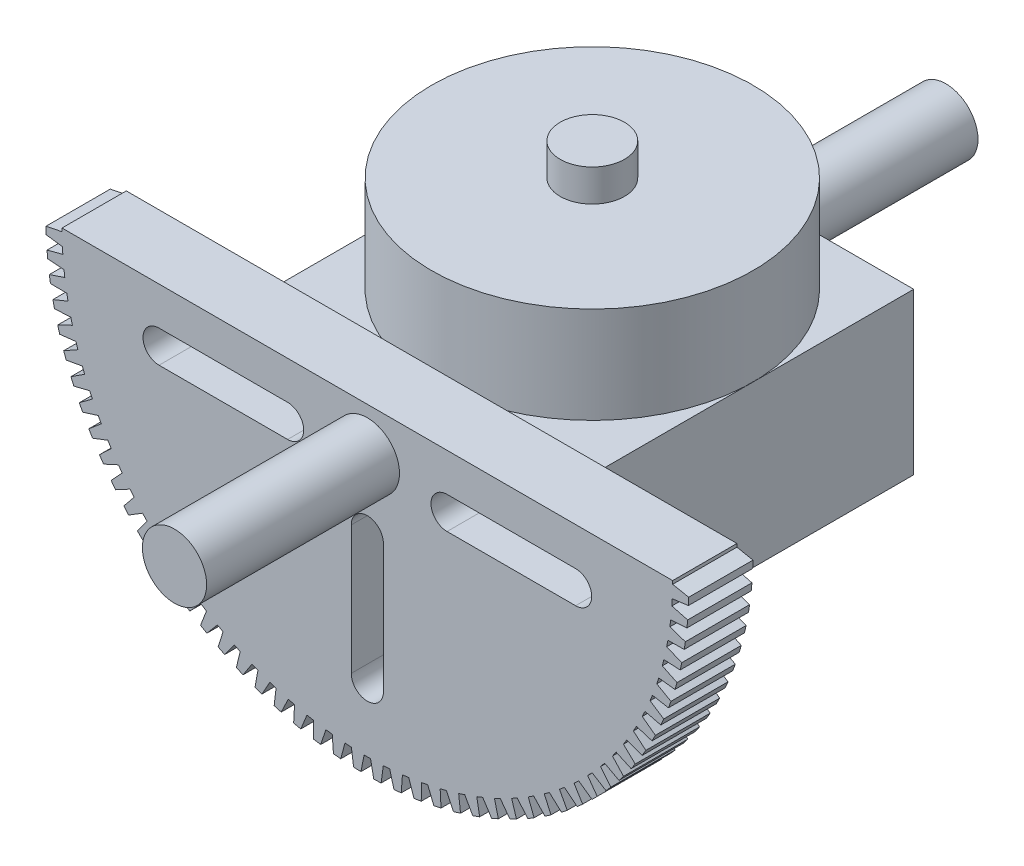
SolidWorks part; units mm, degrees
ref_plane "Front Plane" through (0, 0, 0) normal (0, 0, 1) x (1, 0, 0)
ref_plane "Top Plane" through (0, 0, 0) normal (0, 1, 0) x (1, 0, 0)
ref_plane "Right Plane" through (0, 0, 0) normal (1, 0, 0) x (0, 0, -1)
sketch "Sketch1" plane through (0, 0, 0) normal (0, 0, 1) x (1, 0, 0)
  line L0 (-47.5, 0) -> (-15, 0)
  line L1 (15, 0) -> (47.5, 0)
  line L2 (0, -17.5) -> (0, -37.5) construction
  line L3 (2.5, -17.5) -> (2.5, -37.5)
  line L4 (-2.5, -17.5) -> (-2.5, -37.5)
  line L5 (-32.4018, -8.4364) -> (-12.4018, -8.4364) construction
  line L6 (-32.4018, -5.9364) -> (-12.4018, -5.9364)
  line L7 (-32.4018, -10.9364) -> (-12.4018, -10.9364)
  line L8 (12.4018, -8.4364) -> (32.4018, -8.4364) construction
  line L9 (12.4018, -5.9364) -> (32.4018, -5.9364)
  line L10 (12.4018, -10.9364) -> (32.4018, -10.9364)
  line L11 (0, -47.5) -> (0, -55.9432) construction
  line L12 (-1, -49.99) -> (-0.5, -47.5)
  line L13 (-0.5, -47.5) -> (0.5, -47.5)
  line L14 (0.5, -47.5) -> (1, -49.99)
  line L15 (-4.1369, -49.8286) -> (-3.4816, -47.3749)
  line L16 (-3.4816, -47.3749) -> (-2.4835, -47.4377)
  line L17 (-2.4835, -47.4377) -> (-2.1409, -49.9541)
  line L18 (-7.2575, -49.4705) -> (-6.4494, -47.0628)
  line L19 (-6.4494, -47.0628) -> (-5.4573, -47.1881)
  line L20 (-5.4573, -47.1881) -> (-5.2733, -49.7211)
  line L21 (-10.3495, -48.9172) -> (-9.3918, -46.565)
  line L22 (-9.3918, -46.565) -> (-8.4095, -46.7523)
  line L23 (-8.4095, -46.7523) -> (-8.3849, -49.2919)
  line L24 (-13.4006, -48.1708) -> (-12.2971, -45.8834)
  line L25 (-12.2971, -45.8834) -> (-11.3285, -46.132)
  line L26 (-11.3285, -46.132) -> (-11.4634, -48.6682)
  line L27 (-16.3988, -47.2343) -> (-15.1538, -45.0207)
  line L28 (-15.1538, -45.0207) -> (-14.2028, -45.3297)
  line L29 (-14.2028, -45.3297) -> (-14.4967, -47.8523)
  line L30 (-19.3323, -46.1114) -> (-17.9508, -43.9803)
  line L31 (-17.9508, -43.9803) -> (-17.021, -44.3484)
  line L32 (-17.021, -44.3484) -> (-17.4728, -46.8477)
  line L33 (-22.1895, -44.8065) -> (-20.6769, -42.7664)
  line L34 (-20.6769, -42.7664) -> (-19.7721, -43.1922)
  line L35 (-19.7721, -43.1922) -> (-20.3799, -45.6581)
  line L36 (-24.9592, -43.3248) -> (-23.3215, -41.3837)
  line L37 (-23.3215, -41.3837) -> (-22.4451, -41.8654)
  line L38 (-22.4451, -41.8654) -> (-23.2066, -44.2883)
  line L39 (-27.6303, -41.6721) -> (-25.8739, -39.8377)
  line L40 (-25.8739, -39.8377) -> (-25.0296, -40.3735)
  line L41 (-25.0296, -40.3735) -> (-25.9417, -42.7438)
  line L42 (-30.1924, -39.855) -> (-28.3243, -38.1344)
  line L43 (-28.3243, -38.1344) -> (-27.5153, -38.7222)
  line L44 (-27.5153, -38.7222) -> (-28.5744, -41.0305)
  line L45 (-32.6353, -37.8805) -> (-30.6629, -36.2807)
  line L46 (-30.6629, -36.2807) -> (-29.8924, -36.9181)
  line L47 (-29.8924, -36.9181) -> (-31.0943, -39.1554)
  line L48 (-34.9495, -35.7566) -> (-32.8805, -34.2837)
  line L49 (-32.8805, -34.2837) -> (-32.1515, -34.9683)
  line L50 (-32.1515, -34.9683) -> (-33.4915, -37.1257)
  line L51 (-37.1257, -33.4915) -> (-34.9683, -32.1515)
  line L52 (-34.9683, -32.1515) -> (-34.2837, -32.8805)
  line L53 (-34.2837, -32.8805) -> (-35.7566, -34.9495)
  line L54 (-39.1554, -31.0943) -> (-36.9181, -29.8924)
  line L55 (-36.9181, -29.8924) -> (-36.2807, -30.6629)
  line L56 (-36.2807, -30.6629) -> (-37.8805, -32.6353)
  line L57 (-41.0305, -28.5744) -> (-38.7222, -27.5153)
  line L58 (-38.7222, -27.5153) -> (-38.1344, -28.3243)
  line L59 (-38.1344, -28.3243) -> (-39.855, -30.1924)
  line L60 (-42.7438, -25.9417) -> (-40.3735, -25.0296)
  line L61 (-40.3735, -25.0296) -> (-39.8377, -25.8739)
  line L62 (-39.8377, -25.8739) -> (-41.6721, -27.6303)
  line L63 (-44.2883, -23.2066) -> (-41.8654, -22.4451)
  line L64 (-41.8654, -22.4451) -> (-41.3837, -23.3215)
  line L65 (-41.3837, -23.3215) -> (-43.3248, -24.9592)
  line L66 (-45.6581, -20.3799) -> (-43.1922, -19.7721)
  line L67 (-43.1922, -19.7721) -> (-42.7664, -20.6769)
  line L68 (-42.7664, -20.6769) -> (-44.8065, -22.1895)
  line L69 (-46.8477, -17.4728) -> (-44.3484, -17.021)
  line L70 (-44.3484, -17.021) -> (-43.9803, -17.9508)
  line L71 (-43.9803, -17.9508) -> (-46.1114, -19.3323)
  line L72 (-47.8523, -14.4967) -> (-45.3297, -14.2028)
  line L73 (-45.3297, -14.2028) -> (-45.0207, -15.1538)
  line L74 (-45.0207, -15.1538) -> (-47.2343, -16.3988)
  line L75 (-48.6682, -11.4634) -> (-46.132, -11.3285)
  line L76 (-46.132, -11.3285) -> (-45.8834, -12.2971)
  line L77 (-45.8834, -12.2971) -> (-48.1708, -13.4006)
  line L78 (-49.2919, -8.3849) -> (-46.7523, -8.4095)
  line L79 (-46.7523, -8.4095) -> (-46.565, -9.3918)
  line L80 (-46.565, -9.3918) -> (-48.9172, -10.3495)
  line L81 (-49.7211, -5.2733) -> (-47.1881, -5.4573)
  line L82 (-47.1881, -5.4573) -> (-47.0628, -6.4494)
  line L83 (-47.0628, -6.4494) -> (-49.4705, -7.2575)
  line L84 (-49.9541, -2.1409) -> (-47.4377, -2.4835)
  line L85 (-47.4377, -2.4835) -> (-47.3749, -3.4816)
  line L86 (-47.3749, -3.4816) -> (-49.8286, -4.1369)
  line L87 (-15, 0) -> (15, 0)
  line L88 (-47.5, 0) -> (-47.5, -0.5)
  line L89 (-47.5, -0.5) -> (-49.99, -1)
  line L237 (49.99, -1) -> (47.5, -0.5)
  line L238 (47.5, -0.5) -> (47.5, 0)
  line L240 (49.8286, -4.1369) -> (47.3749, -3.4816)
  line L241 (47.3749, -3.4816) -> (47.4377, -2.4835)
  line L242 (47.4377, -2.4835) -> (49.9541, -2.1409)
  line L243 (49.4705, -7.2575) -> (47.0628, -6.4494)
  line L244 (47.0628, -6.4494) -> (47.1881, -5.4573)
  line L245 (47.1881, -5.4573) -> (49.7211, -5.2733)
  line L246 (48.9172, -10.3495) -> (46.565, -9.3918)
  line L247 (46.565, -9.3918) -> (46.7523, -8.4095)
  line L248 (46.7523, -8.4095) -> (49.2919, -8.3849)
  line L249 (48.1708, -13.4006) -> (45.8834, -12.2971)
  line L250 (45.8834, -12.2971) -> (46.132, -11.3285)
  line L251 (46.132, -11.3285) -> (48.6682, -11.4634)
  line L252 (47.2343, -16.3988) -> (45.0207, -15.1538)
  line L253 (45.0207, -15.1538) -> (45.3297, -14.2028)
  line L254 (45.3297, -14.2028) -> (47.8523, -14.4967)
  line L255 (46.1114, -19.3323) -> (43.9803, -17.9508)
  line L256 (43.9803, -17.9508) -> (44.3484, -17.021)
  line L257 (44.3484, -17.021) -> (46.8477, -17.4728)
  line L258 (44.8065, -22.1895) -> (42.7664, -20.6769)
  line L259 (42.7664, -20.6769) -> (43.1922, -19.7721)
  line L260 (43.1922, -19.7721) -> (45.6581, -20.3799)
  line L261 (43.3248, -24.9592) -> (41.3837, -23.3215)
  line L262 (41.3837, -23.3215) -> (41.8654, -22.4451)
  line L263 (41.8654, -22.4451) -> (44.2883, -23.2066)
  line L264 (41.6721, -27.6303) -> (39.8377, -25.8739)
  line L265 (39.8377, -25.8739) -> (40.3735, -25.0296)
  line L266 (40.3735, -25.0296) -> (42.7438, -25.9417)
  line L267 (39.855, -30.1924) -> (38.1344, -28.3243)
  line L268 (38.1344, -28.3243) -> (38.7222, -27.5153)
  line L269 (38.7222, -27.5153) -> (41.0305, -28.5744)
  line L270 (37.8805, -32.6353) -> (36.2807, -30.6629)
  line L271 (36.2807, -30.6629) -> (36.9181, -29.8924)
  line L272 (36.9181, -29.8924) -> (39.1554, -31.0943)
  line L273 (35.7566, -34.9495) -> (34.2837, -32.8805)
  line L274 (34.2837, -32.8805) -> (34.9683, -32.1515)
  line L275 (34.9683, -32.1515) -> (37.1257, -33.4915)
  line L276 (33.4915, -37.1257) -> (32.1515, -34.9683)
  line L277 (32.1515, -34.9683) -> (32.8805, -34.2837)
  line L278 (32.8805, -34.2837) -> (34.9495, -35.7566)
  line L279 (31.0943, -39.1554) -> (29.8924, -36.9181)
  line L280 (29.8924, -36.9181) -> (30.6629, -36.2807)
  line L281 (30.6629, -36.2807) -> (32.6353, -37.8805)
  line L282 (28.5744, -41.0305) -> (27.5153, -38.7222)
  line L283 (27.5153, -38.7222) -> (28.3243, -38.1344)
  line L284 (28.3243, -38.1344) -> (30.1924, -39.855)
  line L285 (25.9417, -42.7438) -> (25.0296, -40.3735)
  line L286 (25.0296, -40.3735) -> (25.8739, -39.8377)
  line L287 (25.8739, -39.8377) -> (27.6303, -41.6721)
  line L288 (23.2066, -44.2883) -> (22.4451, -41.8654)
  line L289 (22.4451, -41.8654) -> (23.3215, -41.3837)
  line L290 (23.3215, -41.3837) -> (24.9592, -43.3248)
  line L291 (20.3799, -45.6581) -> (19.7721, -43.1922)
  line L292 (19.7721, -43.1922) -> (20.6769, -42.7664)
  line L293 (20.6769, -42.7664) -> (22.1895, -44.8065)
  line L294 (17.4728, -46.8477) -> (17.021, -44.3484)
  line L295 (17.021, -44.3484) -> (17.9508, -43.9803)
  line L296 (17.9508, -43.9803) -> (19.3323, -46.1114)
  line L297 (14.4967, -47.8523) -> (14.2028, -45.3297)
  line L298 (14.2028, -45.3297) -> (15.1538, -45.0207)
  line L299 (15.1538, -45.0207) -> (16.3988, -47.2343)
  line L300 (11.4634, -48.6682) -> (11.3285, -46.132)
  line L301 (11.3285, -46.132) -> (12.2971, -45.8834)
  line L302 (12.2971, -45.8834) -> (13.4006, -48.1708)
  line L303 (8.3849, -49.2919) -> (8.4095, -46.7523)
  line L304 (8.4095, -46.7523) -> (9.3918, -46.565)
  line L305 (9.3918, -46.565) -> (10.3495, -48.9172)
  line L306 (5.2733, -49.7211) -> (5.4573, -47.1881)
  line L307 (5.4573, -47.1881) -> (6.4494, -47.0628)
  line L308 (6.4494, -47.0628) -> (7.2575, -49.4705)
  line L309 (2.1409, -49.9541) -> (2.4835, -47.4377)
  line L310 (2.4835, -47.4377) -> (3.4816, -47.3749)
  line L311 (3.4816, -47.3749) -> (4.1369, -49.8286)
  line L312 (-49.8286, 4.1369) -> (-47.3749, 3.4816)
  line L313 (-49.4705, 7.2575) -> (-47.0628, 6.4494)
  line L314 (-47.0628, 6.4494) -> (-47.1881, 5.4573)
  line L315 (-47.1881, 5.4573) -> (-49.7211, 5.2733)
  line L316 (-48.9172, 10.3495) -> (-46.565, 9.3918)
  line L317 (-46.565, 9.3918) -> (-46.7523, 8.4095)
  line L318 (-46.7523, 8.4095) -> (-49.2919, 8.3849)
  line L319 (-48.1708, 13.4006) -> (-45.8834, 12.2971)
  line L320 (-45.8834, 12.2971) -> (-46.132, 11.3285)
  line L321 (-46.132, 11.3285) -> (-48.6682, 11.4634)
  line L322 (-47.2343, 16.3988) -> (-45.0207, 15.1538)
  line L323 (-45.0207, 15.1538) -> (-45.3297, 14.2028)
  line L324 (-45.3297, 14.2028) -> (-47.8523, 14.4967)
  line L325 (-46.1114, 19.3323) -> (-43.9803, 17.9508)
  line L326 (-43.9803, 17.9508) -> (-44.3484, 17.021)
  line L327 (-44.3484, 17.021) -> (-46.8477, 17.4728)
  line L328 (-44.8065, 22.1895) -> (-42.7664, 20.6769)
  line L329 (-42.7664, 20.6769) -> (-43.1922, 19.7721)
  line L330 (-43.1922, 19.7721) -> (-45.6581, 20.3799)
  line L331 (-43.3248, 24.9592) -> (-41.3837, 23.3215)
  line L332 (-41.3837, 23.3215) -> (-41.8654, 22.4451)
  line L333 (-41.8654, 22.4451) -> (-44.2883, 23.2066)
  line L334 (-41.6721, 27.6303) -> (-39.8377, 25.8739)
  line L335 (-39.8377, 25.8739) -> (-40.3735, 25.0296)
  line L336 (-40.3735, 25.0296) -> (-42.7438, 25.9417)
  line L337 (-39.855, 30.1924) -> (-38.1344, 28.3243)
  line L338 (-38.1344, 28.3243) -> (-38.7222, 27.5153)
  line L339 (-38.7222, 27.5153) -> (-41.0305, 28.5744)
  line L340 (-37.8805, 32.6353) -> (-36.2807, 30.6629)
  line L341 (-36.2807, 30.6629) -> (-36.9181, 29.8924)
  line L342 (-36.9181, 29.8924) -> (-39.1554, 31.0943)
  line L343 (-35.7566, 34.9495) -> (-34.2837, 32.8805)
  line L344 (-34.2837, 32.8805) -> (-34.9683, 32.1515)
  line L345 (-34.9683, 32.1515) -> (-37.1257, 33.4915)
  line L346 (-32.1515, 34.9683) -> (-32.8805, 34.2837)
  line L347 (27.6303, 41.6721) -> (25.8739, 39.8377)
  line L348 (25.8739, 39.8377) -> (25.0296, 40.3735)
  line L349 (25.0296, 40.3735) -> (25.9417, 42.7438)
  line L350 (30.1924, 39.855) -> (28.3243, 38.1344)
  line L351 (28.3243, 38.1344) -> (27.5153, 38.7222)
  line L352 (27.5153, 38.7222) -> (28.5744, 41.0305)
  line L353 (32.6353, 37.8805) -> (30.6629, 36.2807)
  line L354 (30.6629, 36.2807) -> (29.8924, 36.9181)
  line L355 (29.8924, 36.9181) -> (31.0943, 39.1554)
  line L356 (34.9495, 35.7566) -> (32.8805, 34.2837)
  line L357 (32.8805, 34.2837) -> (32.1515, 34.9683)
  line L358 (32.1515, 34.9683) -> (33.4915, 37.1257)
  line L359 (37.1257, 33.4915) -> (34.9683, 32.1515)
  line L360 (34.9683, 32.1515) -> (34.2837, 32.8805)
  line L361 (34.2837, 32.8805) -> (35.7566, 34.9495)
  line L362 (39.1554, 31.0943) -> (36.9181, 29.8924)
  line L363 (36.9181, 29.8924) -> (36.2807, 30.6629)
  line L364 (36.2807, 30.6629) -> (37.8805, 32.6353)
  line L365 (41.0305, 28.5744) -> (38.7222, 27.5153)
  line L366 (38.7222, 27.5153) -> (38.1344, 28.3243)
  line L367 (38.1344, 28.3243) -> (39.855, 30.1924)
  line L368 (42.7438, 25.9417) -> (40.3735, 25.0296)
  line L369 (40.3735, 25.0296) -> (39.8377, 25.8739)
  line L370 (39.8377, 25.8739) -> (41.6721, 27.6303)
  line L371 (44.2883, 23.2066) -> (41.8654, 22.4451)
  line L372 (41.8654, 22.4451) -> (41.3837, 23.3215)
  line L373 (41.3837, 23.3215) -> (43.3248, 24.9592)
  line L374 (45.6581, 20.3799) -> (43.1922, 19.7721)
  line L375 (43.1922, 19.7721) -> (42.7664, 20.6769)
  line L376 (42.7664, 20.6769) -> (44.8065, 22.1895)
  line L377 (46.8477, 17.4728) -> (44.3484, 17.021)
  line L378 (44.3484, 17.021) -> (43.9803, 17.9508)
  line L379 (43.9803, 17.9508) -> (46.1114, 19.3323)
  line L380 (47.8523, 14.4967) -> (45.3297, 14.2028)
  line L381 (45.3297, 14.2028) -> (45.0207, 15.1538)
  line L382 (45.0207, 15.1538) -> (47.2343, 16.3988)
  line L383 (48.6682, 11.4634) -> (46.132, 11.3285)
  line L384 (46.132, 11.3285) -> (45.8834, 12.2971)
  line L385 (45.8834, 12.2971) -> (48.1708, 13.4006)
  line L386 (49.2919, 8.3849) -> (46.7523, 8.4095)
  line L387 (46.7523, 8.4095) -> (46.565, 9.3918)
  line L388 (46.565, 9.3918) -> (48.9172, 10.3495)
  line L389 (49.7211, 5.2733) -> (47.1881, 5.4573)
  line L390 (47.1881, 5.4573) -> (47.0628, 6.4494)
  line L391 (47.0628, 6.4494) -> (49.4705, 7.2575)
  line L392 (49.9541, 2.1409) -> (47.4377, 2.4835)
  line L393 (47.4377, 2.4835) -> (47.3749, 3.4816)
  line L394 (47.3749, 3.4816) -> (49.8286, 4.1369)
  line L395 (47.5, 0.5) -> (49.99, 1)
  line L396 (-33.4915, 37.1257) -> (-32.1515, 34.9683)
  line L397 (-32.8805, 34.2837) -> (-34.9495, 35.7566)
  line L398 (-31.0943, 39.1554) -> (-29.8924, 36.9181)
  line L399 (-29.8924, 36.9181) -> (-30.6629, 36.2807)
  line L400 (-30.6629, 36.2807) -> (-32.6353, 37.8805)
  line L401 (-28.5744, 41.0305) -> (-27.5153, 38.7222)
  line L402 (-27.5153, 38.7222) -> (-28.3243, 38.1344)
  line L403 (-28.3243, 38.1344) -> (-30.1924, 39.855)
  line L404 (-25.9417, 42.7438) -> (-25.0296, 40.3735)
  line L405 (-25.0296, 40.3735) -> (-25.8739, 39.8377)
  line L406 (-25.8739, 39.8377) -> (-27.6303, 41.6721)
  line L407 (-23.2066, 44.2883) -> (-22.4451, 41.8654)
  line L408 (-22.4451, 41.8654) -> (-23.3215, 41.3837)
  line L409 (-23.3215, 41.3837) -> (-24.9592, 43.3248)
  line L410 (-20.3799, 45.6581) -> (-19.7721, 43.1922)
  line L411 (-19.7721, 43.1922) -> (-20.6769, 42.7664)
  line L412 (-20.6769, 42.7664) -> (-22.1895, 44.8065)
  line L413 (-17.4728, 46.8477) -> (-17.021, 44.3484)
  line L414 (-17.021, 44.3484) -> (-17.9508, 43.9803)
  line L415 (-17.9508, 43.9803) -> (-19.3323, 46.1114)
  line L416 (-14.4967, 47.8523) -> (-14.2028, 45.3297)
  line L417 (-14.2028, 45.3297) -> (-15.1538, 45.0207)
  line L418 (-15.1538, 45.0207) -> (-16.3988, 47.2343)
  line L419 (-11.4634, 48.6682) -> (-11.3285, 46.132)
  line L420 (-11.3285, 46.132) -> (-12.2971, 45.8834)
  line L421 (-12.2971, 45.8834) -> (-13.4006, 48.1708)
  line L422 (-8.3849, 49.2919) -> (-8.4095, 46.7523)
  line L423 (-8.4095, 46.7523) -> (-9.3918, 46.565)
  line L424 (-9.3918, 46.565) -> (-10.3495, 48.9172)
  line L425 (-6.4494, 47.0628) -> (-7.2575, 49.4705)
  line L426 (1, 49.99) -> (0.5, 47.5)
  line L427 (4.1369, 49.8286) -> (3.4816, 47.3749)
  line L428 (3.4816, 47.3749) -> (2.4835, 47.4377)
  line L429 (2.4835, 47.4377) -> (2.1409, 49.9541)
  line L430 (7.2575, 49.4705) -> (6.4494, 47.0628)
  line L431 (6.4494, 47.0628) -> (5.4573, 47.1881)
  line L432 (5.4573, 47.1881) -> (5.2733, 49.7211)
  line L433 (10.3495, 48.9172) -> (9.3918, 46.565)
  line L434 (9.3918, 46.565) -> (8.4095, 46.7523)
  line L435 (8.4095, 46.7523) -> (8.3849, 49.2919)
  line L436 (13.4006, 48.1708) -> (12.2971, 45.8834)
  line L437 (12.2971, 45.8834) -> (11.3285, 46.132)
  line L438 (11.3285, 46.132) -> (11.4634, 48.6682)
  line L439 (16.3988, 47.2343) -> (15.1538, 45.0207)
  line L440 (15.1538, 45.0207) -> (14.2028, 45.3297)
  line L441 (14.2028, 45.3297) -> (14.4967, 47.8523)
  line L442 (19.3323, 46.1114) -> (17.9508, 43.9803)
  line L443 (17.9508, 43.9803) -> (17.021, 44.3484)
  line L444 (17.021, 44.3484) -> (17.4728, 46.8477)
  line L445 (22.1895, 44.8065) -> (20.6769, 42.7664)
  line L446 (20.6769, 42.7664) -> (19.7721, 43.1922)
  line L447 (19.7721, 43.1922) -> (20.3799, 45.6581)
  line L448 (24.9592, 43.3248) -> (23.3215, 41.3837)
  line L449 (23.3215, 41.3837) -> (22.4451, 41.8654)
  line L450 (22.4451, 41.8654) -> (23.2066, 44.2883)
  line L451 (-2.1409, 49.9541) -> (-2.4835, 47.4377)
  line L452 (-2.4835, 47.4377) -> (-3.4816, 47.3749)
  line L453 (0.5, 47.5) -> (-0.5, 47.5)
  line L454 (-0.5, 47.5) -> (-1, 49.99)
  line L455 (-3.4816, 47.3749) -> (-4.1369, 49.8286)
  line L456 (-5.2733, 49.7211) -> (-5.4573, 47.1881)
  line L457 (-5.4573, 47.1881) -> (-6.4494, 47.0628)
  line L458 (-47.3749, 3.4816) -> (-47.4377, 2.4835)
  line L459 (-47.4377, 2.4835) -> (-49.9541, 2.1409)
  line L460 (-49.99, 1) -> (-47.5, 0.5)
  arc A0 (-49.99, -1) -> (-49.9541, -2.1409) centre (0, 0) ccw
  circle A1 centre (0, -10) radius 10 construction
  arc A3 (2.5, -17.5) -> (-2.5, -17.5) centre (0, -17.5) ccw
  arc A4 (-2.5, -37.5) -> (2.5, -37.5) centre (0, -37.5) ccw
  arc A5 (-32.4018, -5.9364) -> (-32.4018, -10.9364) centre (-32.4018, -8.4364) ccw
  arc A6 (-12.4018, -10.9364) -> (-12.4018, -5.9364) centre (-12.4018, -8.4364) ccw
  arc A7 (12.4018, -5.9364) -> (12.4018, -10.9364) centre (12.4018, -8.4364) ccw
  arc A8 (32.4018, -10.9364) -> (32.4018, -5.9364) centre (32.4018, -8.4364) ccw
  arc A9 (49.9541, -2.1409) -> (49.99, -1) centre (0, 0) ccw
  arc A10 (49.7211, -5.2733) -> (49.8286, -4.1369) centre (0, 0) ccw
  arc A11 (49.2919, -8.3849) -> (49.4705, -7.2575) centre (0, 0) ccw
  arc A12 (48.6682, -11.4634) -> (48.9172, -10.3495) centre (0, 0) ccw
  arc A13 (47.8523, -14.4967) -> (48.1708, -13.4006) centre (0, 0) ccw
  arc A14 (46.8477, -17.4728) -> (47.2343, -16.3988) centre (0, 0) ccw
  arc A15 (45.6581, -20.3799) -> (46.1114, -19.3323) centre (0, 0) ccw
  arc A16 (44.2883, -23.2066) -> (44.8065, -22.1895) centre (0, 0) ccw
  arc A17 (42.7438, -25.9417) -> (43.3248, -24.9592) centre (0, 0) ccw
  arc A18 (41.0305, -28.5744) -> (41.6721, -27.6303) centre (0, 0) ccw
  arc A19 (39.1554, -31.0943) -> (39.855, -30.1924) centre (0, 0) ccw
  arc A20 (37.1257, -33.4915) -> (37.8805, -32.6353) centre (0, 0) ccw
  arc A21 (34.9495, -35.7566) -> (35.7566, -34.9495) centre (0, 0) ccw
  arc A22 (32.6353, -37.8805) -> (33.4915, -37.1257) centre (0, 0) ccw
  arc A23 (30.1924, -39.855) -> (31.0943, -39.1554) centre (0, 0) ccw
  arc A24 (27.6303, -41.6721) -> (28.5744, -41.0305) centre (0, 0) ccw
  arc A25 (24.9592, -43.3248) -> (25.9417, -42.7438) centre (0, 0) ccw
  arc A26 (22.1895, -44.8065) -> (23.2066, -44.2883) centre (0, 0) ccw
  arc A27 (19.3323, -46.1114) -> (20.3799, -45.6581) centre (0, 0) ccw
  arc A28 (16.3988, -47.2343) -> (17.4728, -46.8477) centre (0, 0) ccw
  arc A29 (13.4006, -48.1708) -> (14.4967, -47.8523) centre (0, 0) ccw
  arc A30 (10.3495, -48.9172) -> (11.4634, -48.6682) centre (0, 0) ccw
  arc A31 (7.2575, -49.4705) -> (8.3849, -49.2919) centre (0, 0) ccw
  arc A32 (4.1369, -49.8286) -> (5.2733, -49.7211) centre (0, 0) ccw
  arc A33 (1, -49.99) -> (2.1409, -49.9541) centre (0, 0) ccw
  arc A34 (-2.1409, -49.9541) -> (-1, -49.99) centre (0, 0) ccw
  arc A35 (-5.2733, -49.7211) -> (-4.1369, -49.8286) centre (0, 0) ccw
  arc A36 (-8.3849, -49.2919) -> (-7.2575, -49.4705) centre (0, 0) ccw
  arc A37 (-11.4634, -48.6682) -> (-10.3495, -48.9172) centre (0, 0) ccw
  arc A38 (-14.4967, -47.8523) -> (-13.4006, -48.1708) centre (0, 0) ccw
  arc A39 (-17.4728, -46.8477) -> (-16.3988, -47.2343) centre (0, 0) ccw
  arc A40 (-20.3799, -45.6581) -> (-19.3323, -46.1114) centre (0, 0) ccw
  arc A41 (-23.2066, -44.2883) -> (-22.1895, -44.8065) centre (0, 0) ccw
  arc A42 (-25.9417, -42.7438) -> (-24.9592, -43.3248) centre (0, 0) ccw
  arc A43 (-28.5744, -41.0305) -> (-27.6303, -41.6721) centre (0, 0) ccw
  arc A44 (-31.0943, -39.1554) -> (-30.1924, -39.855) centre (0, 0) ccw
  arc A45 (-33.4915, -37.1257) -> (-32.6353, -37.8805) centre (0, 0) ccw
  arc A46 (-35.7566, -34.9495) -> (-34.9495, -35.7566) centre (0, 0) ccw
  arc A47 (-37.8805, -32.6353) -> (-37.1257, -33.4915) centre (0, 0) ccw
  arc A48 (-39.855, -30.1924) -> (-39.1554, -31.0943) centre (0, 0) ccw
  arc A49 (-41.6721, -27.6303) -> (-41.0305, -28.5744) centre (0, 0) ccw
  arc A50 (-43.3248, -24.9592) -> (-42.7438, -25.9417) centre (0, 0) ccw
  arc A51 (-44.8065, -22.1895) -> (-44.2883, -23.2066) centre (0, 0) ccw
  arc A52 (-46.1114, -19.3323) -> (-45.6581, -20.3799) centre (0, 0) ccw
  arc A53 (-47.2343, -16.3988) -> (-46.8477, -17.4728) centre (0, 0) ccw
  arc A54 (-48.1708, -13.4006) -> (-47.8523, -14.4967) centre (0, 0) ccw
  arc A55 (-48.9172, -10.3495) -> (-48.6682, -11.4634) centre (0, 0) ccw
  arc A56 (-49.4705, -7.2575) -> (-49.2919, -8.3849) centre (0, 0) ccw
  arc A57 (-49.8286, -4.1369) -> (-49.7211, -5.2733) centre (0, 0) ccw
  point P9 (0, -27.5)
  point P16 (-22.4018, -8.4364)
  point P23 (22.4018, -8.4364)
  point P434 (0, 0)
  dimension "D1" = 20
  dimension "D2" = 50
  dimension "D4" = 5
  dimension "D5" = 20
  dimension "D6" = 5
  dimension "D7" = 20
  dimension "D8" = 5
  dimension "D9" = 20
  dimension "D10" = 1
  dimension "D11" = 0.5
  dimension "D12" = 2
  dimension "D15" = 100
extrude "Boss-Extrude1" add sketch "Sketch1" along normal mid plane 10
sketch "Sketch3" plane through (0, 0, -5) normal (0, 0, -1) x (-1, 0, 0)
  line L0 (0, 0) -> (0, -2) construction
  line L1 (-25, -2) -> (25, -2)
  line L2 (-25, -2) -> (-25, -27)
  line L3 (-25, -27) -> (25, -27)
  line L4 (25, -2) -> (25, -27)
  dimension "D1" = 50
  dimension "D2" = 25
  dimension "D3" = 2
extrude "Boss-Extrude2" add sketch "Sketch3" along normal blind 50
sketch "Sketch4" plane through (0, -2, 0) normal (0, 1, 0) x (1, 0, 0)
  line L0 (-25, 5) -> (25, 5) construction
  line L1 (-25, 55) -> (-25, 5) construction
  circle A0 centre (0, 30) radius 25
  dimension "D1" = 50
  dimension "D2" = 25
  dimension "D3" = 25
extrude "Boss-Extrude5" add sketch "Sketch4" along normal blind 20 separate body
sketch "Sketch5" plane through (0, 18, 0) normal (0, 1, 0) x (1, 0, 0)
  circle A0 centre (0, 30) radius 5
  circle A2 centre (0, 30) radius 25
  circle A3 centre (0, 30) radius 25
  dimension "D2" = 10
  dimension "D1" = 0
extrude "Cut-Extrude1" cut sketch "Sketch5" against normal blind 5
sketch "Sketch6" plane through (0, 0, 0) normal (0, 0, 1) x (1, 0, 0)
  circle A0 centre (0, -6.8096) radius 5
  dimension "D1" = 10
extrude "Boss-Extrude7" add sketch "Sketch6" along normal blind 35 and the other way blind 85 separate body
